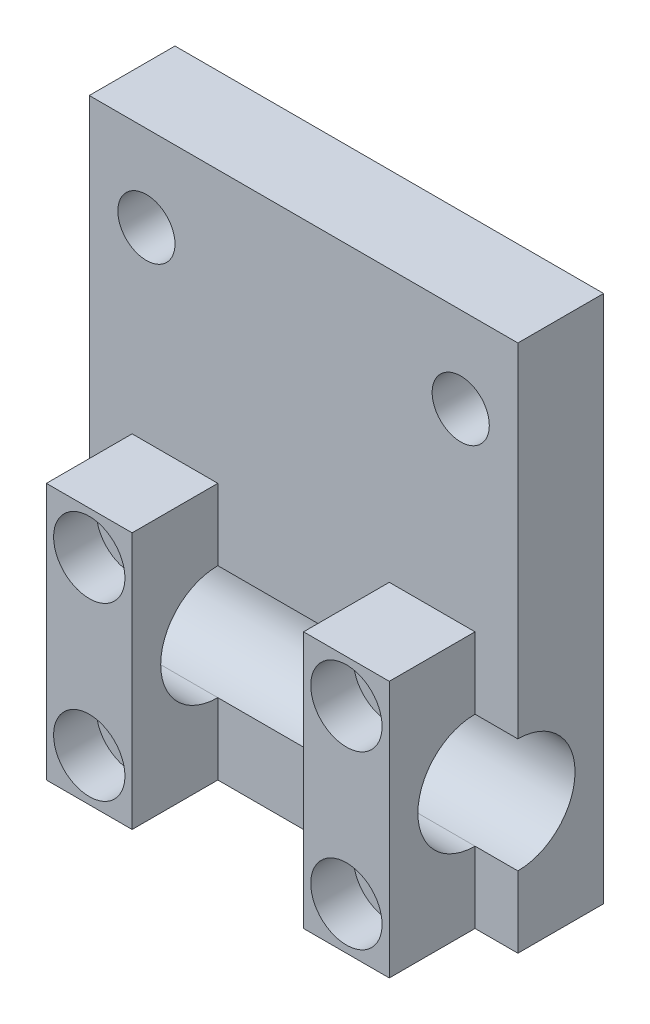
SolidWorks part; units mm, degrees
ref_plane "Front Plane" through (0, 0, 0) normal (0, 0, 1) x (1, 0, 0)
ref_plane "Top Plane" through (0, 0, 0) normal (0, 1, 0) x (1, 0, 0)
ref_plane "Right Plane" through (0, 0, 0) normal (1, 0, 0) x (0, 0, -1)
sketch "Sketch1" plane through (0, 0, 0) normal (0, 0, 1) x (1, 0, 0)
  line L0 (0, 0) -> (0, 38.376) construction
  line L1 (-23.8125, -14.2748) -> (23.8125, -14.2748)
  line L2 (23.8125, -14.2748) -> (23.8125, 44.45)
  line L3 (23.8125, 44.45) -> (-23.8125, 44.45)
  line L4 (-23.8125, 44.45) -> (-23.8125, -14.2748)
  line L5 (0, 0) -> (19.05, 0) construction
  line L6 (-9.525, -14.2748) -> (-9.525, 14.2748)
  line L7 (-9.525, 14.2748) -> (-19.05, 14.2748)
  line L8 (-19.05, 14.2748) -> (-19.05, -14.2748)
  line L9 (19.05, -14.2748) -> (19.05, 14.2748)
  line L10 (19.05, 14.2748) -> (9.525, 14.2748)
  line L11 (9.525, 14.2748) -> (9.525, -14.2748)
  line L12 (-14.2875, -9.525) -> (-14.2875, -1.5853) construction
  line L13 (14.2875, -9.525) -> (14.2875, -1.5853) construction
  circle A0 centre (17.4625, 34.925) radius 3.175
  circle A1 centre (-17.4625, 34.925) radius 3.175
  circle A2 centre (-14.2875, -9.525) radius 2.3876
  circle A3 centre (-14.2875, 9.525) radius 2.3876
  circle A4 centre (14.2875, 9.525) radius 2.3876
  circle A5 centre (14.2875, -9.525) radius 2.3876
  circle A6 centre (14.2875, 9.525) radius 3.9624
  circle A7 centre (-14.2875, 9.525) radius 3.9624
  circle A8 centre (-14.2875, -9.525) radius 3.9624
  circle A9 centre (14.2875, -9.525) radius 3.9624
  dimension "D4" = 6.35
  dimension "D9" = 7.9248
  dimension "D10" = 4.7752
  dimension "D1" = 47.625
  dimension "D2" = 14.2748
  dimension "D3" = 9.525
  dimension "D5" = 34.925
  dimension "D6" = 44.45
  dimension "D7" = 19.05
  dimension "D8" = 28.575
  dimension "D11" = 9.525
  dimension "D12" = 38.1
  dimension "D13" = 4.7625
  dimension "D14" = 4.7498
  dimension "D15" = 28.5496
sketch "Sketch2" plane through (0, 0, 0) normal (0, 0, 1) x (1, 0, 0)
  line L0 (-23.8125, -14.2748) -> (23.8125, -14.2748) construction
  line L1 (23.8125, -14.2748) -> (23.8125, 44.45) construction
  line L2 (23.8125, 44.45) -> (-23.8125, 44.45) construction
  line L3 (-23.8125, 44.45) -> (-23.8125, -14.2748) construction
  line L4 (-23.8125, -14.2748) -> (23.8125, -14.2748)
  line L5 (23.8125, -14.2748) -> (23.8125, 44.45)
  line L6 (23.8125, 44.45) -> (-23.8125, 44.45)
  line L7 (-23.8125, 44.45) -> (-23.8125, -14.2748)
  circle A0 centre (-14.2875, -9.525) radius 2.3876 construction
  circle A1 centre (14.2875, -9.525) radius 2.3876 construction
  circle A2 centre (14.2875, 9.525) radius 2.3876 construction
  circle A3 centre (-14.2875, 9.525) radius 2.3876 construction
  circle A4 centre (17.4625, 34.925) radius 3.175 construction
  circle A5 centre (-17.4625, 34.925) radius 3.175 construction
  circle A6 centre (-14.2875, -9.525) radius 2.3876
  circle A7 centre (14.2875, -9.525) radius 2.3876
  circle A8 centre (14.2875, 9.525) radius 2.3876
  circle A9 centre (-14.2875, 9.525) radius 2.3876
  circle A10 centre (17.4625, 34.925) radius 3.175
  circle A11 centre (-17.4625, 34.925) radius 3.175
extrude "Boss-Extrude1" add sketch "Sketch2" against normal blind 9.525
sketch "Sketch3" plane through (0, 0, 0) normal (0, 0, 1) x (1, 0, 0)
  line L0 (-9.525, -14.2748) -> (-9.525, 14.2748) construction
  line L1 (-9.525, 14.2748) -> (-19.05, 14.2748) construction
  line L2 (-19.05, 14.2748) -> (-19.05, -14.2748) construction
  line L3 (-23.8125, -14.2748) -> (23.8125, -14.2748) construction
  line L4 (19.05, -14.2748) -> (19.05, 14.2748) construction
  line L5 (19.05, 14.2748) -> (9.525, 14.2748) construction
  line L6 (9.525, 14.2748) -> (9.525, -14.2748) construction
  line L7 (-9.525, -14.2748) -> (-9.525, 14.2748)
  line L8 (-9.525, 14.2748) -> (-19.05, 14.2748)
  line L9 (-19.05, 14.2748) -> (-19.05, -14.2748)
  line L10 (-19.05, -14.2748) -> (-9.525, -14.2748)
  line L11 (19.05, -14.2748) -> (19.05, 14.2748)
  line L12 (19.05, 14.2748) -> (9.525, 14.2748)
  line L13 (9.525, 14.2748) -> (9.525, -14.2748)
  line L14 (9.525, -14.2748) -> (19.05, -14.2748)
  circle A0 centre (14.2875, -9.525) radius 2.3876 construction
  circle A1 centre (14.2875, 9.525) radius 2.3876 construction
  circle A2 centre (-14.2875, 9.525) radius 2.3876 construction
  circle A3 centre (-14.2875, -9.525) radius 2.3876 construction
  circle A4 centre (14.2875, -9.525) radius 2.3876
  circle A5 centre (14.2875, 9.525) radius 2.3876
  circle A6 centre (-14.2875, 9.525) radius 2.3876
  circle A7 centre (-14.2875, -9.525) radius 2.3876
extrude "Boss-Extrude2" add sketch "Sketch3" along normal blind 9.525 separate body
sketch "Sketch4" plane through (0, 0, 0) normal (0, 0, 1) x (1, 0, 0)
  circle A0 centre (-14.2875, 9.525) radius 3.9624 construction
  circle A1 centre (-14.2875, -9.525) radius 3.9624 construction
  circle A2 centre (14.2875, -9.525) radius 3.9624 construction
  circle A3 centre (14.2875, 9.525) radius 3.9624 construction
  circle A4 centre (-14.2875, 9.525) radius 3.9624
  circle A5 centre (-14.2875, -9.525) radius 3.9624
  circle A6 centre (14.2875, -9.525) radius 3.9624
  circle A7 centre (14.2875, 9.525) radius 3.9624
extrude "Cut-Extrude1" cut sketch "Sketch4" along normal blind 9.525 from offset 4.7752
sketch "Sketch5" plane through (0, 0, 0) normal (1, 0, 0) x (0, 0, -1)
  circle A0 centre (0, 0) radius 6.35
  dimension "D1" = 12.7
extrude "Cut-Extrude2" cut sketch "Sketch5" against normal mid plane 76.2
